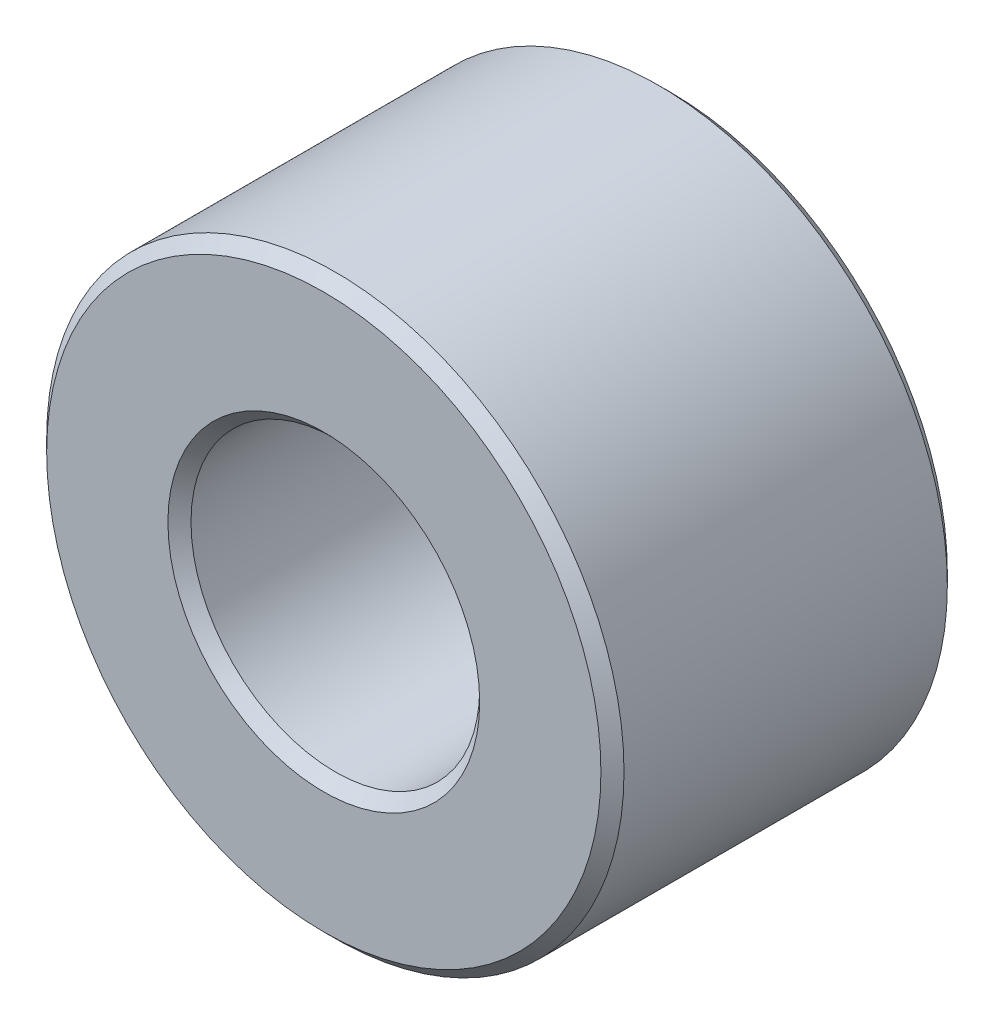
SolidWorks part; units mm, degrees
ref_plane "Front Plane" through (0, 0, 0) normal (0, 0, 1) x (1, 0, 0)
ref_plane "Top Plane" through (0, 0, 0) normal (0, 1, 0) x (1, 0, 0)
ref_plane "Right Plane" through (0, 0, 0) normal (1, 0, 0) x (0, 0, -1)
sketch "Sketch1" plane through (0, 0, 0) normal (0, 0, 1) x (1, 0, 0)
  circle A0 centre (0, 0) radius 2.5
  circle A1 centre (0, 0) radius 1.25
  dimension "D1" = 5
  dimension "D2" = 2.5
extrude "Boss-Extrude2" add sketch "Sketch1" along normal mid plane 3
chamfer "Chamfer3" distance 0.1 angle 45 4 edges at (2.5, 0, 1.5) (2.5, 0, -1.5) (1.25, 0, -1.5) (1.25, 0, 1.5)
